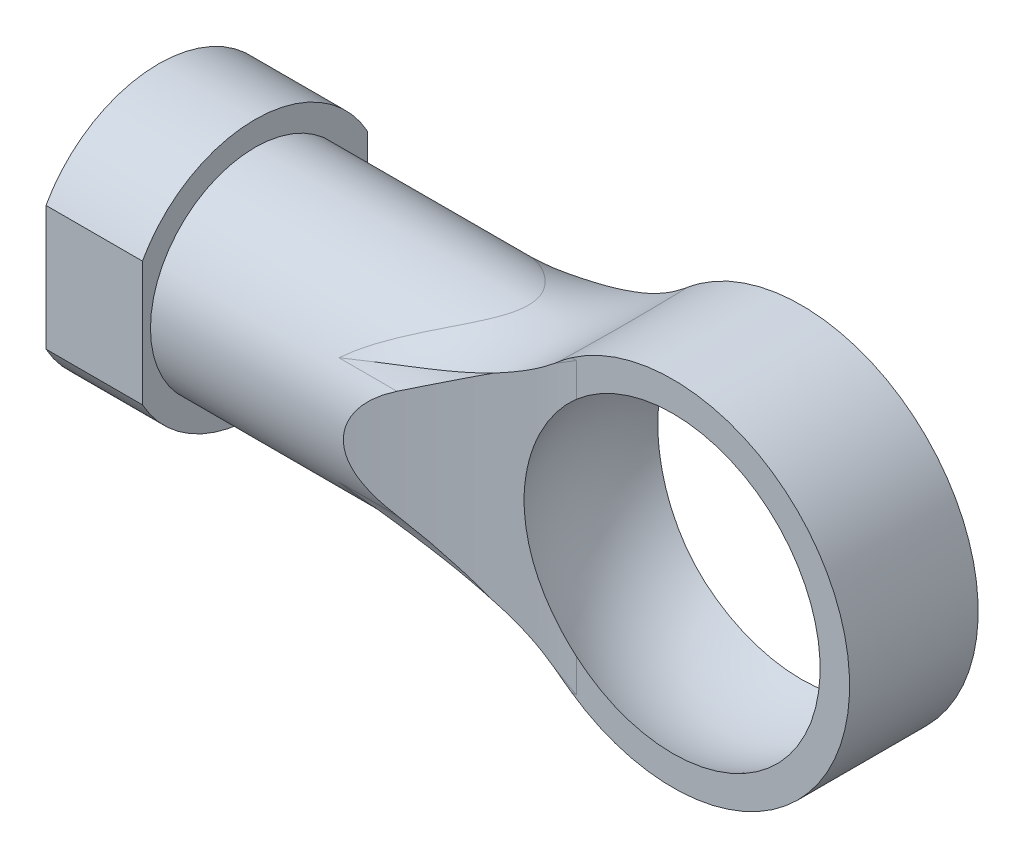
SolidWorks part; units mm, degrees
ref_plane "Face" through (0, 0, 0) normal (0, 0, 1) x (1, 0, 0)
ref_plane "Dessus" through (0, 0, 0) normal (0, 1, 0) x (1, 0, 0)
ref_plane "Droite" through (0, 0, 0) normal (1, 0, 0) x (0, 0, -1)
sketch "Esquisse2" plane through (0, 0, 0) normal (0, 0, 1) x (1, 0, 0)
  line L0 (0, 0) -> (0, 8)
  line L1 (0, 8) -> (6, 8)
  line L2 (6, 8) -> (6, 6.5)
  line L3 (6, 6.5) -> (30, 6.5)
  line L4 (30, 6.5) -> (30, 0)
  line L5 (30, 0) -> (0, 0)
  line L6 (83.1923, 0) -> (-18.8277, 0) construction
  dimension "D1" = 16
  dimension "D2" = 24
  dimension "D3" = 13
  dimension "D4" = 6
revolve "Révolution1" add sketch "Esquisse2" angle 360 about L6
sketch "Esquisse3" plane through (0, 0, 0) normal (0, 0, 1) x (1, 0, 0)
  line L0 (0, 8) -> (0, -8) construction
  circle A0 centre (36, 0) radius 11
  dimension "D1" = 36
  dimension "D2" = 22
extrude "Extrusion1" add sketch "Esquisse3" along normal mid plane 8
sketch "Esquisse4" plane through (0, 0, 0) normal (0, 1, 0) x (1, 0, 0)
  line L0 (30, 6.5) -> (6, 6.5) construction
  line L1 (26.266, -4) -> (30, -4) construction
  line L2 (6, -6.5) -> (30, -6.5) construction
  line L3 (30, 4) -> (30, 6.5) construction
  line L4 (30, -6.5) -> (30, -4) construction
  line L5 (26.266, 4) -> (30, 4) construction
  line L6 (18, 6.5) -> (30, 6.5)
  line L7 (30, 6.5) -> (30, 4)
  line L8 (30, -4) -> (30, -6.5)
  line L9 (30, -6.5) -> (18, -6.5)
  arc A0 (30, 4) -> (18, 6.5) centre (30, 34.05) cw
  arc A1 (30, -4) -> (18, -6.5) centre (30, -34.05) ccw
  dimension "D1" = 12
  dimension "D2" = 12
extrude "Enlèv. mat.-Extru.1" cut sketch "Esquisse4" against normal through all and the other way through all
fillet "Congé1" radius 10 1 edges at (27.1252, 6.4991, 0.1097)
fillet "Congé2" radius 10 1 edges at (27.1252, -6.4991, -0.1097)
fillet "Congé3" radius 11 1 edges at (24.7561, -5.1235, 4)
fillet "Congé4" radius 11 1 edges at (24.7561, 5.1235, 4)
fillet "Congé5" radius 11 2 edges at (24.7561, -5.1235, -4) (24.7561, 5.1235, -4)
sketch "Esquisse5" plane through (0, 0, 0) normal (0, 1, 0) x (1, 0, 0)
  line L0 (36, 12.6611) -> (36, -10.5798) construction
  line L1 (0, 8) -> (0, -8) construction
  line L2 (36, 10) -> (36, -10)
  arc A0 (36, -10) -> (36, 10) centre (36, 0) ccw
  dimension "D1" = 20
  dimension "D2" = 36
revolve "Enlèvement de matière-Révolution1" cut sketch "Esquisse5" angle 360 about L0
hole_wizard "Trou taraudé M81" positions "Esquisse7" profile "Esquisse6" tap size "M8" standard "ISO"
sketch "Esquisse7" plane through (0, 0, 0) normal (-1, 0, 0) x (0, 0, 1)
  point P0 (0, 0)
sketch "Esquisse6" plane through (0, 0, 0) normal (0, 1, 0) x (0, 0, 1)
  line L0 (0, 0) -> (0, 20.0429)
  line L1 (0, 20.0429) -> (3.4, 18)
  line L2 (3.4, 18) -> (3.4, 0)
  line L5 (3.4, 0) -> (0, 0)
  line L10 (0, 20.0429) -> (-3.4, 18) construction
  line L11 (0, -6.35) -> (0, 107.95) construction
  dimension "Diamètre du trou pour taraudage" = 6.8
  dimension "Profondeur du trou pour taraudage" = 18
  dimension "Angle de pointe" = 118
sketch "Esquisse8" plane through (0, 0, 0) normal (-1, 0, 0) x (0, 0, 1)
  line L1 (7, 6.759) -> (10.432, 6.759)
  line L2 (7, 6.759) -> (7, -7.2493)
  line L3 (7, -7.2493) -> (10.432, -7.2493)
  line L4 (10.432, 6.759) -> (10.432, -7.2493)
  line L5 (-13.0936, 8.475) -> (-7, 8.475)
  line L6 (-13.0936, 8.475) -> (-13.0936, -8.475)
  line L7 (-13.0936, -8.475) -> (-7, -8.475)
  line L8 (-7, 8.475) -> (-7, -8.475)
  dimension "D1" = 14
  dimension "D2" = 7
extrude "Enlèv. mat.-Extru.2" cut sketch "Esquisse8" against normal through all
